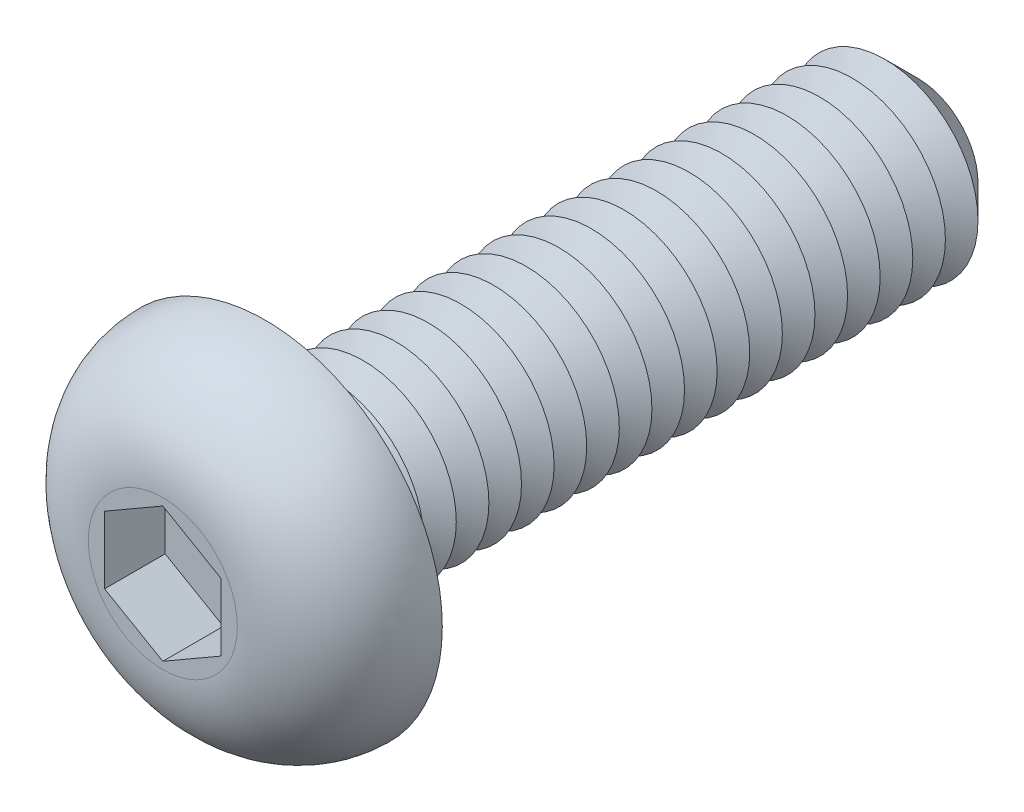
SolidWorks part; units mm, degrees
ref_plane "Front Plane" through (0, 0, 0) normal (0, 0, 1) x (1, 0, 0)
ref_plane "Top Plane" through (0, 0, 0) normal (0, 1, 0) x (1, 0, 0)
ref_plane "Right Plane" through (0, 0, 0) normal (1, 0, 0) x (0, 0, -1)
sketch "Sketch1" plane through (0, 0, 0) normal (1, 0, 0) x (0, 0, -1)
  line L0 (-47.9342, 0) -> (60.3146, 0) construction
sketch "Sketch2" plane through (0, 0, 0) normal (1, 0, 0) x (0, 0, -1)
  line L0 (0, 0) -> (-2.2, 0)
  line L1 (-47.9342, 0) -> (60.3146, 0) construction
  line L2 (-2.2, 0) -> (-2.2, 1.6)
  line L3 (0, 3.8) -> (0, 0)
  arc A0 (-2.2, 1.6) -> (0, 3.8) centre (0, 1.6) cw
  dimension "D1" = 2.2
  dimension "D2" = 2.2
  dimension "D3" = 3.8
revolve "Revolve1" add sketch "Sketch2" angle 360 about L0
sketch "Sketch3" plane through (0, 0, 2.2) normal (0, 0, 1) x (1, 0, 0)
  line L1 (0, 1.4434) -> (-1.25, 0.7217)
  line L2 (-1.25, 0.7217) -> (-1.25, -0.7217)
  line L3 (-1.25, -0.7217) -> (0, -1.4434)
  line L4 (0, -1.4434) -> (1.25, -0.7217)
  line L5 (1.25, -0.7217) -> (1.25, 0.7217)
  line L6 (1.25, 0.7217) -> (0, 1.4434)
  circle A0 centre (0, 0) radius 1.25 construction
  dimension "D1" = 2.5
extrude "Cut-Extrude1" cut sketch "Sketch3" against normal blind 1.3
sketch "Sketch4" plane through (0, 0, 0) normal (0, 0, -1) x (-1, 0, 0)
  circle A0 centre (0, 0) radius 2
  dimension "D1" = 4
extrude "Boss-Extrude1" add sketch "Sketch4" along normal blind 14
chamfer "Chamfer1" distance 0.7 angle 45 1 edges at (-2, 0, -14)
sketch "Sketch5" plane through (0, 0, 0) normal (1, 0, 0) x (0, 0, -1)
  line L0 (0.7, 2) -> (1.4, 2)
  line L1 (13.3, 2) -> (0, 2) construction
  line L2 (1.4, 2) -> (1.05, 1.3938)
  line L3 (1.05, 1.3938) -> (0.7, 2)
  line L4 (0, -3.8) -> (0, 3.8) construction
  line L5 (13.3, 2) -> (0, 2) construction
  dimension "D1" = 0.7
  dimension "D2" = 0.7
revolve "Cut-Revolve1" cut sketch "Sketch5" angle 360 about L0
pattern_linear "LPattern1" count 18 spacing 0.7 along (0, 0, -1) of "Cut-Revolve1"
fillet "Fillet2" radius 0.35 1 edges at (2, 0, 0)
sketch "Sketch6" plane through (0, 0, 0.9) normal (0, 0, 1) x (1, 0, 0)
  circle A0 centre (0, 0) radius 0.5
  dimension "D1" = 1
extrude "Cut-Extrude2" cut sketch "Sketch6" against normal up to surface (14.9 mm away)
